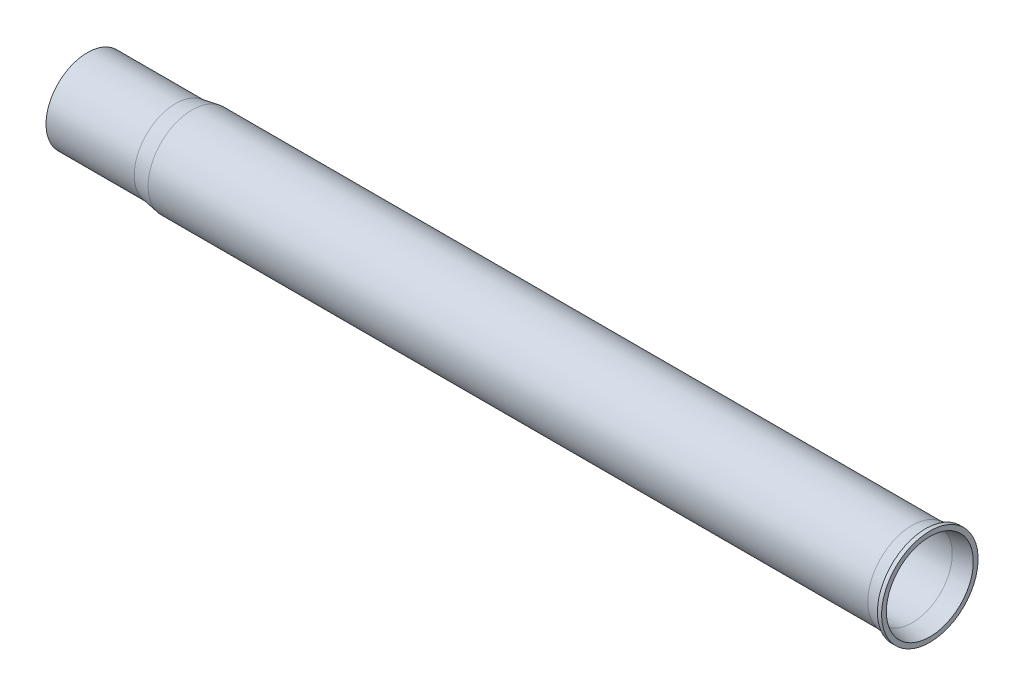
SolidWorks part; units mm, degrees
ref_plane "Plan1" through (0, 0, 0) normal (0, 0, 1) x (1, 0, 0)
ref_plane "Plan2" through (0, 0, 0) normal (0, 1, 0) x (1, 0, 0)
ref_plane "Plan3" through (0, 0, 0) normal (1, 0, 0) x (0, 0, -1)
sketch "Esquisse1" plane through (0, 0, 0) normal (0, 0, 1) x (1, 0, 0)
  line L0 (0, 0) -> (97, 0) construction
  line L1 (0, 15) -> (32, 15)
  line L2 (32, 15) -> (38, 16)
  line L3 (38, 16) -> (299, 16)
  line L4 (299, 16) -> (304, 17)
  line L5 (299.1485, 14.5) -> (305.5, 15.7703)
  line L6 (38.1241, 14.5) -> (299.1485, 14.5)
  line L7 (32.1241, 13.5) -> (38.1241, 14.5)
  line L8 (0, 13.5) -> (32.1241, 13.5)
  line L9 (0, 15) -> (0, 13.5)
  line L10 (304, 17) -> (304, 17.5)
  line L11 (304, 17.5) -> (305.5, 17.5)
  line L12 (305.5, 17.5) -> (305.5, 15.7703)
  dimension "D1" = 15
  dimension "D2" = 16
  dimension "D3" = 17
  dimension "D4" = 32
  dimension "D5" = 6
  dimension "D6" = 304
  dimension "D7" = 5
  dimension "D9" = 1.5
  dimension "D10" = 35
  dimension "D8" = 1.5
revolve "Base-Révolution" add sketch "Esquisse1" angle 360 about L0
